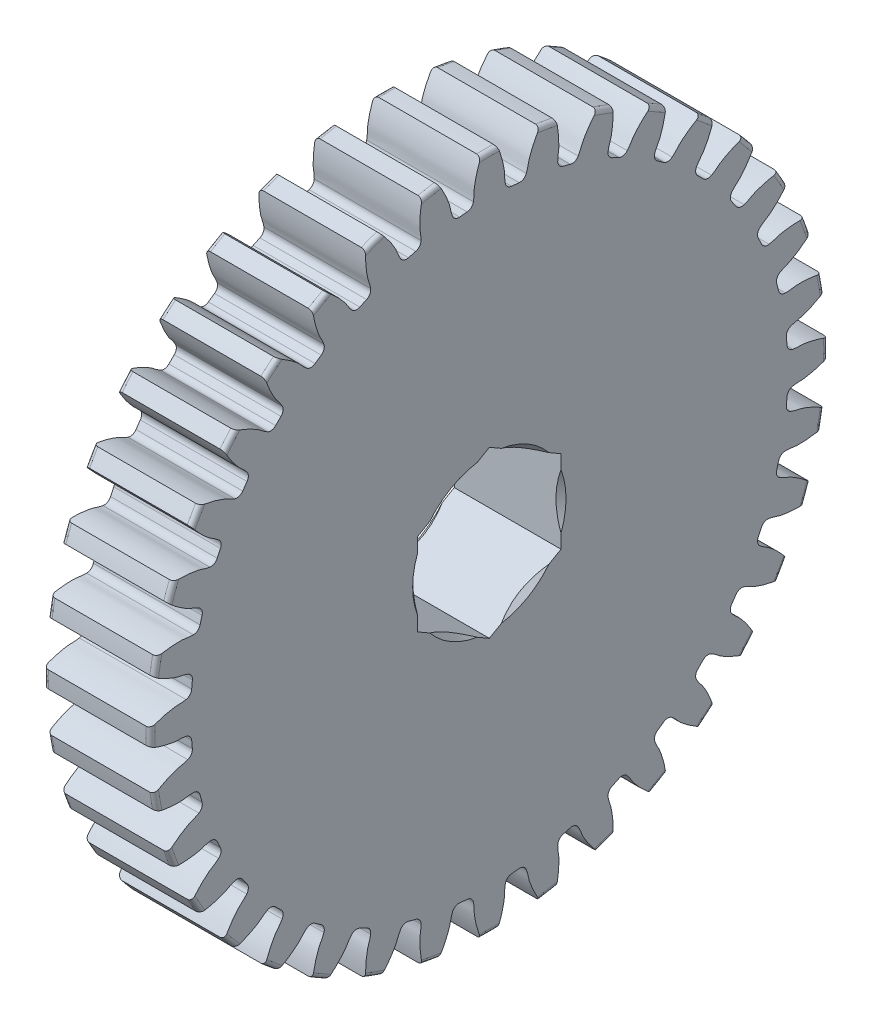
SolidWorks part; units mm, degrees
ref_plane "Front Plane" through (0, 0, 0) normal (0, 0, 1) x (1, 0, 0)
ref_plane "Top Plane" through (0, 0, 0) normal (0, 1, 0) x (1, 0, 0)
ref_plane "Right Plane" through (0, 0, 0) normal (1, 0, 0) x (0, 0, -1)
imported_body "Imported1"
sketch "Sketch1" plane through (-2.3749, 0, 0) normal (-1, 0, 0) x (0, 0, 1)
  line L0 (0, 3.6808) -> (-3.1877, 1.8404)
  line L1 (0, -3.6808) -> (3.1877, -1.8404)
  line L2 (3.1877, -1.8404) -> (3.1877, 1.8404)
  line L3 (3.1877, 1.8404) -> (0, 3.6808)
  line L4 (-3.1877, 1.8404) -> (-3.1877, -1.8404)
  line L5 (-3.1877, -1.8404) -> (0, -3.6808)
  line L6 (0, -3.6808) -> (0, 0) construction
  circle A0 centre (0, 0) radius 3.1877 construction
  dimension "D1" = 6.3754
extrude "Cut-Extrude1" cut sketch "Sketch1" against normal through all
